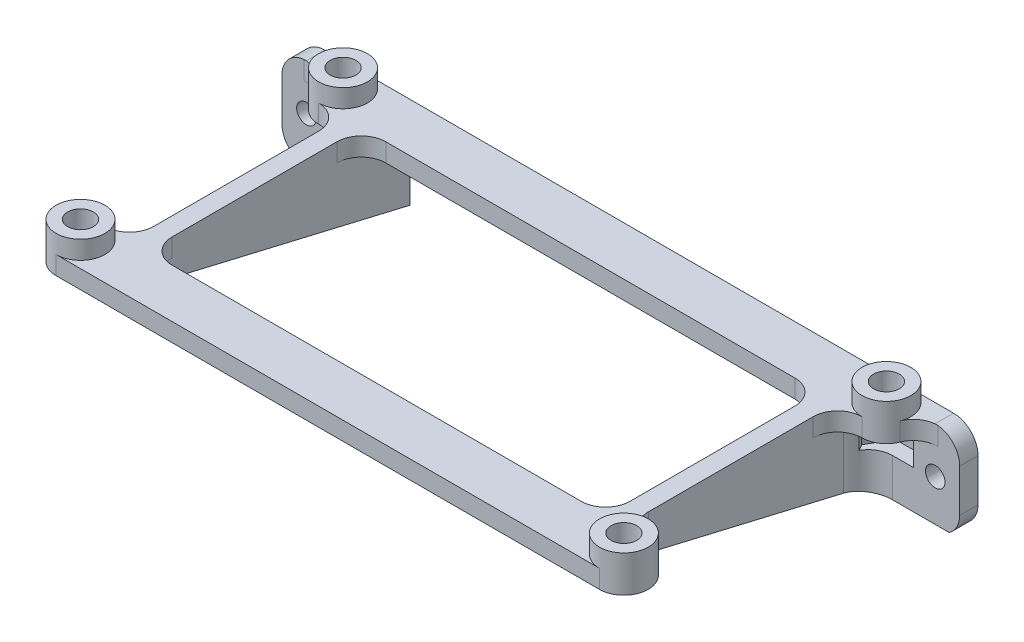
SolidWorks part; units mm, degrees
ref_plane "Front Plane" through (0, 0, 0) normal (0, 0, 1) x (1, 0, 0)
ref_plane "Top Plane" through (0, 0, 0) normal (0, 1, 0) x (1, 0, 0)
ref_plane "Right Plane" through (0, 0, 0) normal (1, 0, 0) x (0, 0, -1)
sketch "Sketch3" plane through (0, 0, 0) normal (0, 1, 0) x (1, 0, 0)
  line L0 (0, 0) -> (89, 0) construction
  line L1 (0, 0) -> (0, -43) construction
  circle A0 centre (0, 0) radius 2.1
  circle A1 centre (0, 0) radius 4
  circle A2 centre (89, 0) radius 2.1
  circle A3 centre (89, 0) radius 4
  circle A4 centre (89, -43) radius 2.1
  circle A5 centre (89, -43) radius 4
  circle A6 centre (0, -43) radius 2.1
  circle A7 centre (0, -43) radius 4
  dimension "D1" = 4.2
  dimension "D2" = 8
  dimension "D5" = 89
  dimension "D6" = 43
  dimension "D3" = 2
  dimension "D4" = 2
extrude "Boss-Extrude2" add sketch "Sketch3" along normal blind 3
sketch "Sketch4" plane through (0, 0, 0) normal (0, 1, 0) x (1, 0, 0)
  line L0 (44.5, 4) -> (44.5, -47) construction
  line L1 (0, 4) -> (89, 4)
  line L3 (0, -47) -> (89, -47)
  line L5 (7, -4) -> (82, -4)
  line L6 (4, -4) -> (4, -39)
  line L7 (7, -39) -> (82, -39)
  line L8 (85, -4) -> (85, -39)
  line L9 (7, -4) -> (7, -39)
  line L10 (82, -4) -> (82, -39)
  line L11 (4, -4) -> (0, -4)
  line L12 (4, -39) -> (0, -39)
  line L13 (85, -39) -> (89, -39)
  line L14 (85, -4) -> (89, -4)
  circle A0 centre (0, 0) radius 4 construction
  circle A1 centre (89, -43) radius 4 construction
  arc A2 (0, 4) -> (0, -4) centre (0, 0) ccw
  circle A3 centre (89, 0) radius 4 construction
  circle A4 centre (0, -43) radius 4 construction
  circle A5 centre (0, -43) radius 2.1 construction
  circle A6 centre (0, 0) radius 2.1 construction
  circle A7 centre (89, 0) radius 2.1 construction
  circle A8 centre (89, -43) radius 2.1 construction
  arc A9 (89, -4) -> (89, 4) centre (89, 0) ccw
  arc A10 (89, -47) -> (89, -39) centre (89, -43) ccw
  arc A11 (0, -39) -> (0, -47) centre (0, -43) ccw
  circle A12 centre (0, -43) radius 2.1
  circle A13 centre (0, 0) radius 2.1
  circle A14 centre (89, 0) radius 2.1
  circle A15 centre (89, -43) radius 2.1
  dimension "D1" = 3
extrude "Boss-Extrude3" add sketch "Sketch4" against normal blind 3
ref_plane "Plane1" through (44.5, 0, 0) normal (-1, 0, 0) x (0, 0, 1)
sketch "Sketch6" plane through (4, 0, 0) normal (-1, 0, 0) x (0, 0, 1)
  line L0 (-4, -3) -> (47, -3)
  line L1 (47, -3) -> (-4, -15)
  line L2 (-4, -15) -> (-4, -3)
  line L3 (4, 0) -> (39, 0) construction
  dimension "D1" = 15
extrude "Boss-Extrude5" add sketch "Sketch6" against normal blind 3
mirror "Mirror2" about plane through (44.5, 0, 0) normal (-1, 0, 0) of "Boss-Extrude5"
sketch "Sketch7" plane through (0, 0, -4) normal (0, 0, -1) x (-1, 0, 0)
  line L0 (-100, -7.5) -> (-85, -7.5) construction
  line L1 (-85, -15) -> (-100, -15)
  line L2 (-85, -15) -> (-85, 0)
  line L3 (-85, 0) -> (-100, 0)
  line L4 (-100, -15) -> (-100, 0)
  line L5 (-93, 3) -> (-93, -3) construction
  line L6 (-89, 0) -> (0, 0) construction
  circle A0 centre (-96, -7.5) radius 1.6
  dimension "D1" = 3.2
  dimension "D2" = 3
  dimension "D3" = 4
extrude "Boss-Extrude6" add sketch "Sketch7" against normal blind 3
mirror "Mirror3" about plane through (44.5, 0, 0) normal (-1, 0, 0) of "Boss-Extrude6"
fillet "Fillet1" radius 4 4 edges at (100, 0, -2.5) (100, -15, -2.5) (-11, 0, -2.5) (-11, -15, -2.5)
sketch "Sketch8" plane through (44.5, 0, 0) normal (-1, 0, 0) x (0, 0, 1)
  line L0 (-4, -15) -> (-1, -14.2941) construction
  line L1 (-1, -15) -> (-4, -15) construction
  line L2 (-1, -15) -> (-1, -14.2941) construction
  line L3 (-4, -15) -> (-1, -14.2941)
  line L4 (-1, -15) -> (-4, -15)
  line L5 (-1, -15) -> (-1, -14.2941)
extrude "Cut-Extrude2" cut sketch "Sketch8" against normal through all both and the other way through all
fillet "Fillet2" radius 4 12 edges at (92.873, -1.5, -1) (85, -8.6471, -1) (-3.873, -1.5, -1) (4, -8.6471, -1) (85, -1.5, 4) (85, -1.5, 39) (82, -1.5, 39) (82, -1.5, 4)
sketch "Sketch9" plane through (0, 0, 0) normal (0, 1, 0) x (1, 0, 0)
  circle A0 centre (0, 0) radius 2.1 construction
  circle A1 centre (89, 0) radius 2.1 construction
  circle A2 centre (0, 0) radius 2.1
  circle A3 centre (89, 0) radius 2.1
extrude "Cut-Extrude3" cut sketch "Sketch9" against normal blind 8
sketch "Sketch10" plane through (0, -3, 0) normal (0, -1, 0) x (1, 0, 0)
  line L1 (-4.0415, 0) -> (-2.0207, -3.5)
  line L2 (-2.0207, -3.5) -> (2.0207, -3.5)
  line L3 (2.0207, -3.5) -> (4.0415, 0)
  line L4 (4.0415, 0) -> (2.0207, 3.5)
  line L5 (2.0207, 3.5) -> (-2.0207, 3.5)
  line L6 (-2.0207, 3.5) -> (-4.0415, 0)
  circle A0 centre (0, 0) radius 3.5 construction
  dimension "D1" = 7
extrude "Cut-Extrude4" cut sketch "Sketch10" along normal blind 5
mirror "Mirror4" about plane through (44.5, 0, 0) normal (-1, 0, 0) of "Cut-Extrude4"
